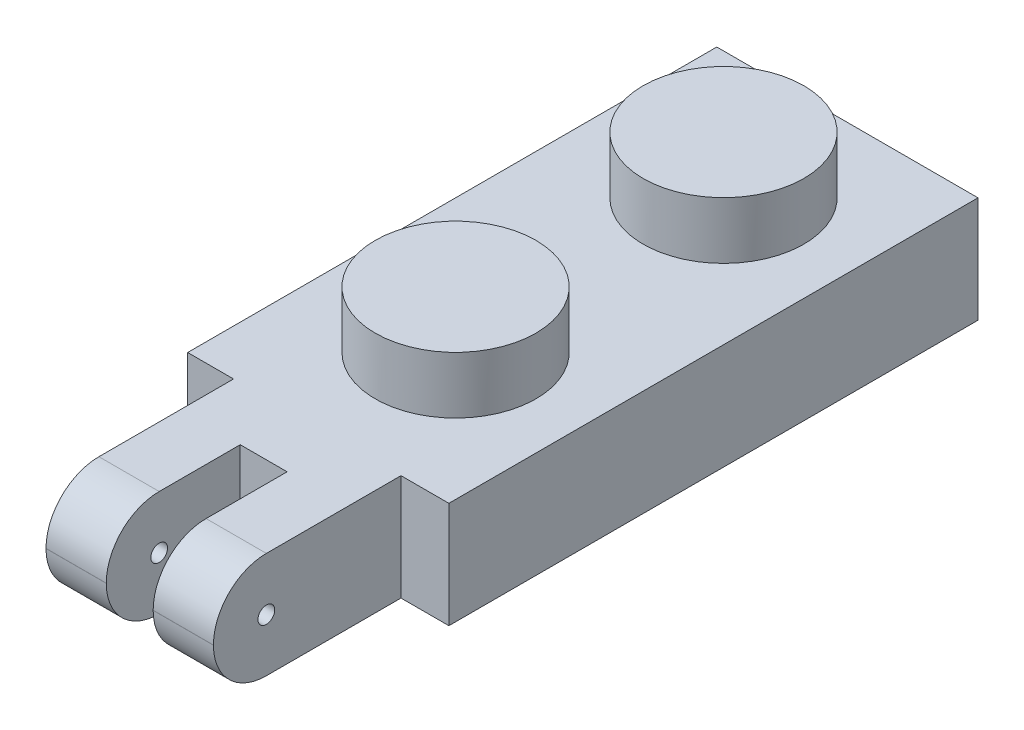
SolidWorks part; units mm, degrees
ref_plane "Front Plane" through (0, 0, 0) normal (0, 0, 1) x (1, 0, 0)
ref_plane "Top Plane" through (0, 0, 0) normal (0, 1, 0) x (1, 0, 0)
ref_plane "Right Plane" through (0, 0, 0) normal (1, 0, 0) x (0, 0, -1)
sketch "Sketch1" plane through (0, 0, 0) normal (0, 1, 0) x (1, 0, 0)
  line L1 (0, 0) -> (7.8, 0)
  line L2 (0, 0) -> (0, 15.8)
  line L3 (0, 15.8) -> (7.8, 15.8)
  line L4 (7.8, 0) -> (7.8, 15.8)
  dimension "D1" = 7.8
  dimension "D2" = 15.8
extrude "Extrude1" add sketch "Sketch1" along normal blind 3.166
sketch "Sketch2" plane through (0, 3.166, 0) normal (0, 1, 0) x (1, 0, 0)
  circle A0 centre (4, 4) radius 2.4
  point P6 (9.3567, 6.1688)
  dimension "D1" = 4.8
extrude "Extrude2" add sketch "Sketch2" along normal blind 1.7
sketch "Sketch3" plane through (0, 0, 0) normal (0, -1, 0) x (1, 0, 0)
  line L0 (7.8, 0) -> (7.8, -15.8) construction
  line L1 (1.45, -9.45) -> (6.35, -9.45)
  line L2 (1.45, -9.45) -> (1.45, -14.35)
  line L3 (1.45, -14.35) -> (6.35, -14.35)
  line L4 (6.35, -9.45) -> (6.35, -14.35)
  line L5 (7.8, -15.8) -> (0, -15.8) construction
  dimension "D1" = 4.9
  dimension "D2" = 1.45
  dimension "D3" = 1.45
extrude "Extrude3" cut sketch "Sketch3" against normal blind 2.5
sketch "Sketch4" plane through (0, 3.166, 0) normal (0, 1, 0) x (1, 0, 0)
  line L0 (3.9, 0) -> (3.9, 16.3566) construction
  line L1 (0, 0) -> (7.8, 0) construction
pattern_linear "LPattern1" count 2 spacing 8 along (0, 0, -1) of "Extrude2"
pattern_linear "LPattern2" count 2 spacing 8 along (0, 0, 1) of "Extrude3"
sketch "Sketch5" plane through (0, 0, 0) normal (0, 0, 1) x (1, 0, 0)
  line L0 (3.9, 3.166) -> (3.9, -0.4845) construction
  line L1 (0, 3.166) -> (7.8, 3.166) construction
  line L2 (0, 0) -> (7.8, 0) construction
  line L3 (1.37, 3.166) -> (6.37, 3.166)
  line L4 (1.37, 3.166) -> (1.37, 0)
  line L5 (1.37, 0) -> (6.37, 0)
  line L6 (6.37, 3.166) -> (6.37, 0)
  dimension "D1" = 5
  dimension "D2" = 2.53
extrude "Boss-Extrude1" add sketch "Sketch5" along normal blind 5.6
sketch "Sketch6" plane through (0, 0, 5.6) normal (0, 0, 1) x (1, 0, 0)
  line L0 (6.37, 3.166) -> (1.37, 3.166) construction
  line L1 (3.17, 3.166) -> (4.57, 3.166)
  line L2 (3.17, 3.166) -> (3.17, 0)
  line L3 (3.17, 0) -> (4.57, 0)
  line L4 (4.57, 3.166) -> (4.57, 0)
  line L5 (1.37, 0) -> (6.37, 0) construction
  line L6 (1.37, 3.166) -> (1.37, 0) construction
  line L7 (6.37, 0) -> (6.37, 3.166) construction
  dimension "D1" = 1.8
  dimension "D2" = 1.8
extrude "Cut-Extrude1" cut sketch "Sketch6" against normal blind 4
fillet "Fillet2" radius 1.58 4 edges at (2.27, 0, 5.6) (5.47, 0, 5.6) (5.47, 3.166, 5.6) (2.27, 3.166, 5.6)
sketch "Sketch7" plane through (1.37, 0, 0) normal (-1, 0, 0) x (0, 0, 1)
  circle A0 centre (4.02, 1.58) radius 0.25
  dimension "D1" = 0.5
extrude "Cut-Extrude2" cut sketch "Sketch7" against normal through all
